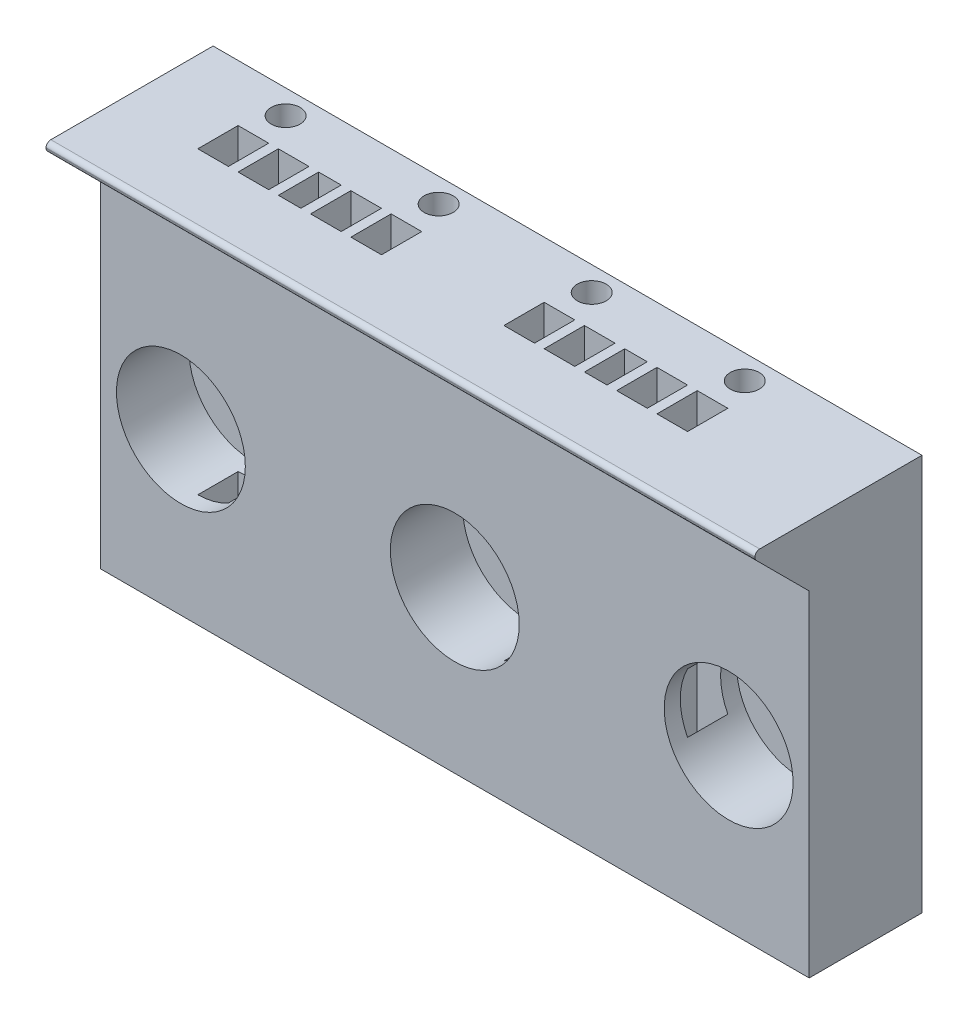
SolidWorks part; units mm, degrees
ref_plane "前视基准面" through (0, 0, 0) normal (0, 0, 1) x (1, 0, 0)
ref_plane "上视基准面" through (0, 0, 0) normal (0, 1, 0) x (1, 0, 0)
ref_plane "右视基准面" through (0, 0, 0) normal (1, 0, 0) x (0, 0, -1)
sketch "草图1" plane through (0, 0, 0) normal (0, 0, 1) x (1, 0, 0)
  line L0 (0, 24.6) -> (44, 24.6)
  line L1 (0, 0) -> (44, 0)
  line L2 (0, 0) -> (0, 24.6)
  line L3 (44, 0) -> (44, 24.6)
  circle A0 centre (5, 10) radius 2.25
  circle A1 centre (22, 10) radius 2.25
  circle A2 centre (39, 10) radius 2.25
extrude "凸台-拉伸1" add sketch "草图1" along normal blind 10.371
sketch "草图2" plane through (44, 0, 0) normal (1, 0, 0) x (0, 0, -1)
  line L0 (0, 0) -> (0, 24.6)
  line L1 (-7, 0) -> (0, 0)
  line L2 (-10.0711, 24.6) -> (0, 24.6)
  line L3 (-10.2838, 24.0879) -> (-7, 20.8041)
  line L4 (-7, 0) -> (-7, 20.8041)
  arc A0 (-10.0711, 24.6) -> (-10.2838, 24.0879) centre (-10.0716, 24.3) ccw
extrude "切除-拉伸1" cut sketch "草图2" against normal through all flip side to cut
sketch "草图3" plane through (0, 0, 7) normal (0, 0, 1) x (1, 0, 0)
  circle A0 centre (5, 10) radius 4
  circle A1 centre (22, 10) radius 4
  circle A2 centre (39, 10) radius 4
extrude "切除-拉伸2" cut sketch "草图3" against normal blind 4.5
sketch "草图4" plane through (0, 24.6, 0) normal (0, 1, 0) x (1, 0, 0)
  line L0 (5.05, -3.5) -> (6.95, -3.5)
  line L1 (5.05, -6) -> (6.95, -6)
  line L2 (5.05, -3.5) -> (5.05, -6)
  line L3 (6.95, -3.5) -> (6.95, -6)
  line L4 (7.55, -3.5) -> (7.55, -6)
  line L5 (9.45, -3.5) -> (9.45, -6)
  line L6 (10.05, -3.5) -> (10.05, -6)
  line L7 (11.45, -3.5) -> (11.45, -6)
  line L8 (12.05, -3.5) -> (12.05, -6)
  line L9 (13.95, -3.5) -> (13.95, -6)
  line L10 (14.55, -3.5) -> (14.55, -6)
  line L11 (16.45, -3.5) -> (16.45, -6)
  line L12 (7.55, -6) -> (9.45, -6)
  line L13 (7.55, -3.5) -> (9.45, -3.5)
  line L14 (10.05, -3.5) -> (11.45, -3.5)
  line L15 (10.05, -6) -> (11.45, -6)
  line L16 (12.05, -6) -> (13.95, -6)
  line L17 (12.05, -3.5) -> (13.95, -3.5)
  line L18 (14.55, -3.5) -> (16.45, -3.5)
  line L19 (14.55, -6) -> (16.45, -6)
  line L20 (33.55, -6) -> (35.45, -6)
  line L21 (33.55, -3.5) -> (35.45, -3.5)
  line L22 (31.05, -3.5) -> (32.95, -3.5)
  line L23 (31.05, -6) -> (32.95, -6)
  line L24 (29.05, -6) -> (30.45, -6)
  line L25 (29.05, -3.5) -> (30.45, -3.5)
  line L26 (26.55, -3.5) -> (28.45, -3.5)
  line L27 (26.55, -6) -> (28.45, -6)
  line L28 (35.45, -3.5) -> (35.45, -6)
  line L29 (33.55, -3.5) -> (33.55, -6)
  line L30 (32.95, -3.5) -> (32.95, -6)
  line L31 (31.05, -3.5) -> (31.05, -6)
  line L32 (30.45, -3.5) -> (30.45, -6)
  line L33 (29.05, -3.5) -> (29.05, -6)
  line L34 (28.45, -3.5) -> (28.45, -6)
  line L35 (26.55, -3.5) -> (26.55, -6)
  line L36 (25.95, -3.5) -> (25.95, -6)
  line L37 (24.05, -6) -> (25.95, -6)
  line L38 (24.05, -3.5) -> (25.95, -3.5)
  line L39 (24.05, -3.5) -> (24.05, -6)
extrude "切除-拉伸3" cut sketch "草图4" against normal through all
sketch "草图5" plane through (0, 24.6, 0) normal (0, 1, 0) x (1, 0, 0)
  circle A0 centre (6, -1.5) radius 0.9
  circle A1 centre (15.5, -1.5) radius 0.9
  circle A2 centre (25, -1.5) radius 0.9
  circle A3 centre (34.5, -1.5) radius 0.9
extrude "切除-拉伸4" cut sketch "草图5" against normal through all
